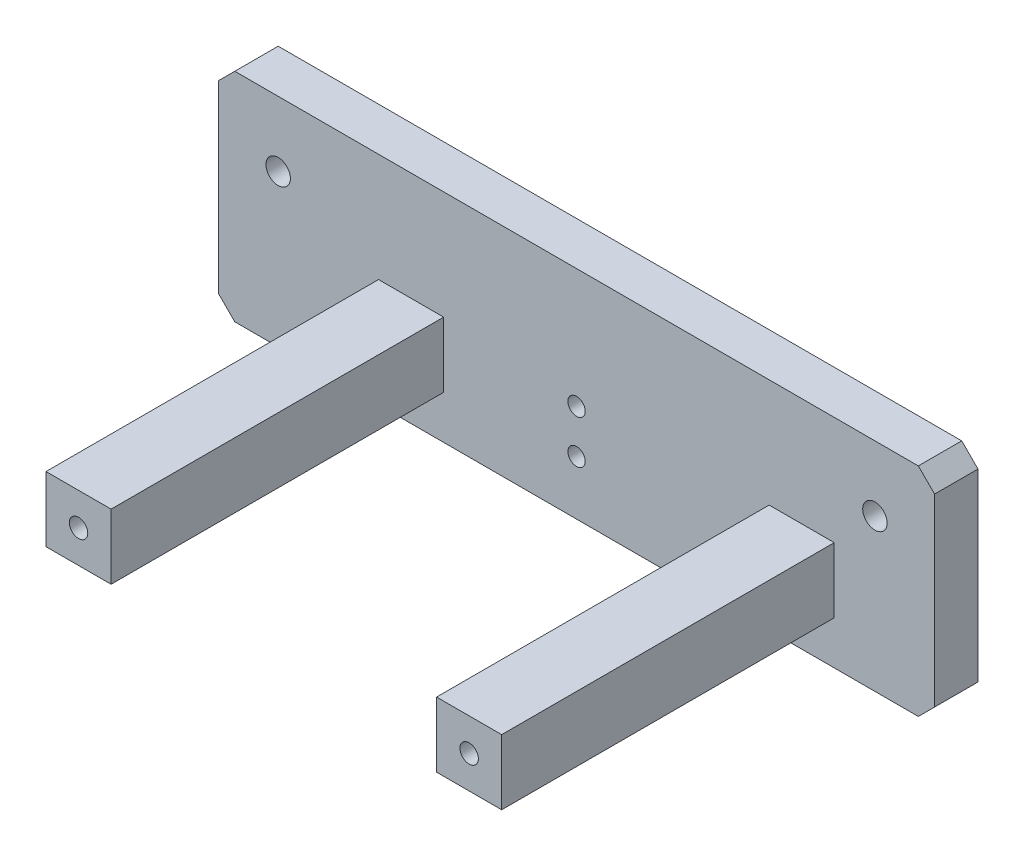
SolidWorks part; units mm, degrees
ref_plane "前视基准面" through (0, 0, 0) normal (0, 0, 1) x (1, 0, 0)
ref_plane "上视基准面" through (0, 0, 0) normal (0, 1, 0) x (1, 0, 0)
ref_plane "右视基准面" through (0, 0, 0) normal (1, 0, 0) x (0, 0, -1)
other "Configuration Table"
sketch "草图1" plane through (0, 0, 0) normal (0, 0, 1) x (1, 0, 0)
  line L0 (-63, -20) -> (63, -20)
  line L1 (63, -20) -> (66, -17)
  line L2 (66, -17) -> (66, 17)
  line L3 (66, 17) -> (63, 20)
  line L4 (63, 20) -> (-63, 20)
  line L5 (-63, 20) -> (-66, 17)
  line L6 (-66, 17) -> (-66, -17)
  line L7 (-66, -17) -> (-63, -20)
  circle A0 centre (-55, 8) radius 2.25
  circle A1 centre (55, 8) radius 2.25
  circle A2 centre (-30.5, -6) radius 1.7
  circle A3 centre (41.5, -6) radius 1.7
  circle A4 centre (0, -10) radius 1.6
  circle A5 centre (0, -2) radius 1.6
  dimension "D1" = 4.5
  dimension "D2" = 3.2
  dimension "D3" = 3.4
  dimension "D4" = 41.5
  dimension "D5" = 55
  dimension "D6" = 63
  dimension "D7" = 66
  dimension "D8" = 30.5
  dimension "D9" = 55
  dimension "D10" = 63
  dimension "D11" = 8
  dimension "D12" = 17
  dimension "D13" = 20
  dimension "D14" = 2
  dimension "D15" = 6
  dimension "D16" = 10
  dimension "D17" = 17
extrude "Common_flange_M4_pitch110" add sketch "草图1" along normal blind 8
sketch "草图2" plane through (0, 0, 0) normal (0, 0, 1) x (1, 0, 0)
  line L0 (-36.5, -12) -> (-24.5, -12)
  line L1 (-24.5, -12) -> (-24.5, 0)
  line L2 (-24.5, 0) -> (-36.5, 0)
  line L3 (-36.5, 0) -> (-36.5, -12)
  line L4 (35.5, -12) -> (47.5, -12)
  line L5 (47.5, -12) -> (47.5, 0)
  line L6 (47.5, 0) -> (35.5, 0)
  line L7 (35.5, 0) -> (35.5, -12)
  circle A0 centre (-30.5, -6) radius 1.7
  circle A1 centre (41.5, -6) radius 1.7
  dimension "D1" = 3.4
  dimension "D2" = 35.5
  dimension "D3" = 41.5
  dimension "D4" = 47.5
  dimension "D5" = 24.5
  dimension "D6" = 30.5
  dimension "D7" = 6
extrude "Fixed_length_arms_M3_through" add sketch "草图2" along normal blind 61.3 from offset 8
